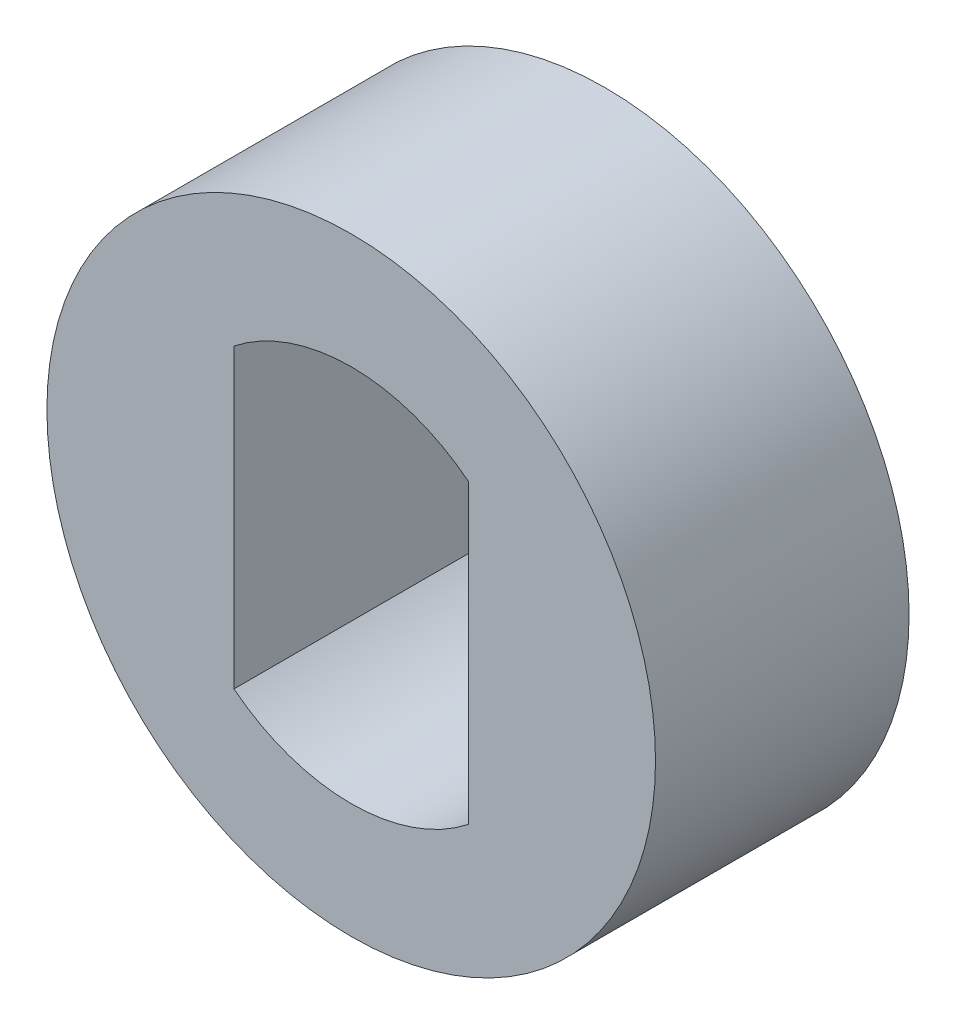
SolidWorks part; units mm, degrees
ref_plane "Plan de face" through (0, 0, 0) normal (0, 0, 1) x (1, 0, 0)
ref_plane "Plan de dessus" through (0, 0, 0) normal (0, 1, 0) x (1, 0, 0)
ref_plane "Plan de droite" through (0, 0, 0) normal (1, 0, 0) x (0, 0, -1)
sketch "Esquisse1" plane through (0, 0, 0) normal (0, 0, 1) x (1, 0, 0)
  line L0 (1.85, 2.3421) -> (1.85, -2.3421)
  line L1 (0, 6.771) -> (0, -10.1963) construction
  line L2 (-1.85, 2.3421) -> (-1.85, -2.3421)
  arc A0 (1.85, 2.3421) -> (-1.85, 2.3421) centre (0, 0) ccw
  arc A1 (-1.85, -2.3421) -> (1.85, -2.3421) centre (0, 0) ccw
  circle A2 centre (0, 0) radius 4.8
  dimension "D1" = 1.85
extrude "Boss.-Extru.1" add sketch "Esquisse1" along normal blind 4
sketch "Esquisse2" plane through (0, 0, 0) normal (0, 0, -1) x (-1, 0, 0)
  line L0 (-6.6752, 0) -> (7.3485, 0)
  line L1 (0, 5.1407) -> (0, -5.4515)
